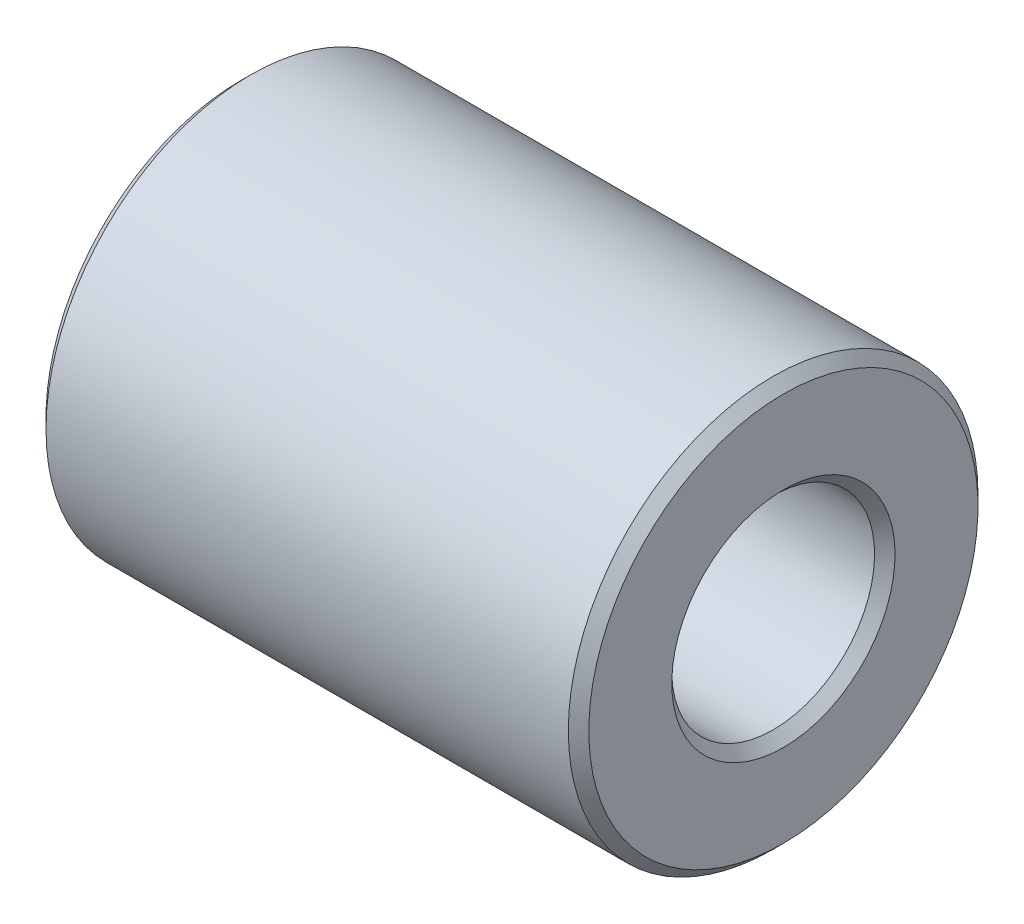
SolidWorks part; units mm, degrees
ref_plane "Front Plane" through (0, 0, 0) normal (0, 0, 1) x (1, 0, 0)
ref_plane "Top Plane" through (0, 0, 0) normal (0, 1, 0) x (1, 0, 0)
ref_plane "Right Plane" through (0, 0, 0) normal (1, 0, 0) x (0, 0, -1)
sketch "Esquisse1" plane through (0, 0, 0) normal (0, 0, 1) x (1, 0, 0)
  line L0 (0, 9.5) -> (0, 5.45)
  line L1 (0, 5.45) -> (0.5, 4.95)
  line L2 (0.5, 4.95) -> (26, 4.95)
  line L3 (26, 4.95) -> (26.5, 5.45)
  line L4 (26.5, 5.45) -> (26.5, 9.5)
  line L5 (26.5, 9.5) -> (26, 10)
  line L6 (26, 10) -> (0.5, 10)
  line L7 (0.5, 10) -> (0, 9.5)
  line L8 (36.8385, 0) -> (-36.8385, 0) construction
  dimension "D1" = 20
  dimension "D2" = 9.9
  dimension "D3" = 26.5
  dimension "D4" = 135
  dimension "D5" = 0.5
revolve "Révolution1" add sketch "Esquisse1" angle 360 about L8
